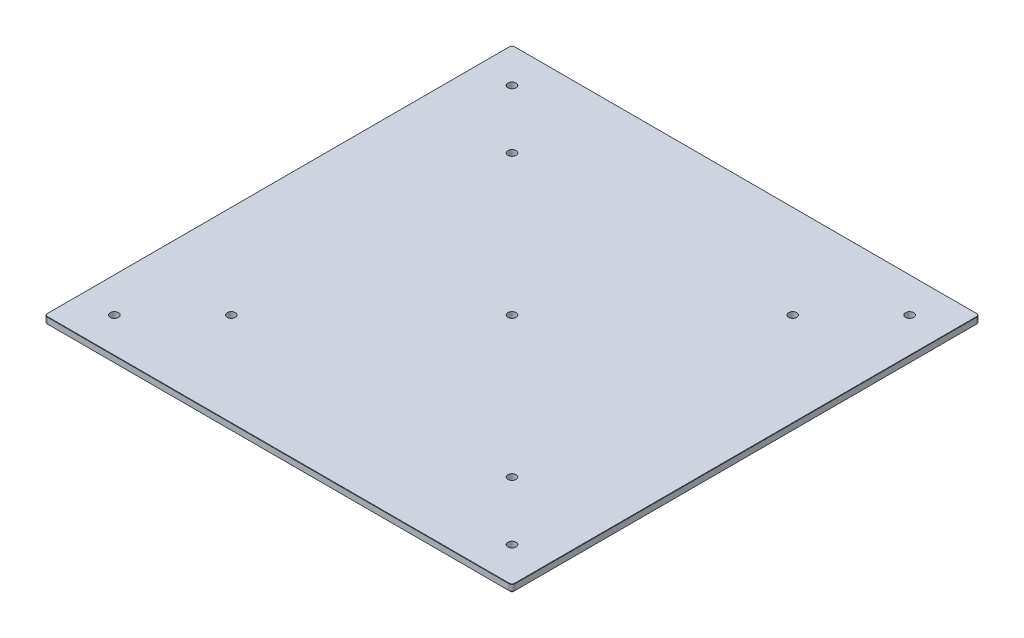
SolidWorks part; units mm, degrees
ref_plane "Front" through (0, 0, 0) normal (0, 0, 1) x (1, 0, 0)
ref_plane "Top" through (0, 0, 0) normal (0, 1, 0) x (1, 0, 0)
ref_plane "Right" through (0, 0, 0) normal (1, 0, 0) x (0, 0, -1)
sketch "Sketch1" plane through (0, 0, 0) normal (0, 1, 0) x (1, 0, 0)
  line L1 (-190.5, -190.5) -> (190.5, -190.5)
  line L2 (-190.5, -190.5) -> (-190.5, 190.5)
  line L3 (-190.5, 190.5) -> (190.5, 190.5)
  line L4 (190.5, -190.5) -> (190.5, 190.5)
  line L5 (-190.5, -190.5) -> (190.5, 190.5) construction
  line L6 (-190.5, 190.5) -> (190.5, -190.5) construction
  point P0 (0, 0)
  dimension "D1" = 381
extrude "Boss-Extrude1" add sketch "Sketch1" against normal blind 6.35
fillet "Fillet1" radius 2.54 4 edges at (190.5, -3.175, 190.5) (190.5, -3.175, -190.5) (-190.5, -3.175, -190.5) (-190.5, -3.175, 190.5)
chamfer "Chamfer1" distance 1.27 angle 45 8 edges at (0, -6.35, -190.5) (-189.7561, -6.35, -189.7561) (189.7561, -6.35, -189.7561) (-190.5, -6.35, 0) (190.5, -6.35, 0) (-189.7561, -6.35, 189.7561) (189.7561, -6.35, 189.7561) (0, -6.35, 190.5)
hole_wizard "1/4 Clearance Hole1" positions "Sketch3" profile "Sketch2" hole size "1/4" standard "Ansi Inch"
sketch "Sketch3" plane through (0, -6.35, 0) normal (0, -1, 0) x (1, 0, 0)
  line L1 (-114.3, 114.3) -> (114.3, 114.3)
  line L2 (-114.3, 114.3) -> (-114.3, -114.3)
  line L3 (-114.3, -114.3) -> (114.3, -114.3)
  line L4 (114.3, 114.3) -> (114.3, -114.3)
  line L5 (-114.3, 114.3) -> (114.3, -114.3) construction
  line L6 (-114.3, -114.3) -> (114.3, 114.3) construction
  point P0 (114.3, 114.3)
  point P3 (114.3, -114.3)
  point P7 (0, 0)
  point P12 (-114.3, 114.3)
  point P16 (-114.3, -114.3)
  point P19 (0, 0)
  dimension "D1" = 228.6
sketch "Sketch2" plane through (114.3, -6.35, 114.3) normal (1, 0, 0) x (0, 0, -1)
  line L0 (0, 0) -> (0, 6.35)
  line L1 (0, 6.35) -> (3.3782, 6.35)
  line L2 (3.3782, 6.35) -> (3.3782, 0)
  line L5 (3.3782, 0) -> (0, 0)
  line L11 (0, -6.35) -> (0, 107.95) construction
  dimension "Thru Hole Dia." = 6.7564
  dimension "Thru Hole Depth" = 6.35
chamfer "Chamfer2" distance 0.254 angle 45 8 edges at (0, 0, -190.5) (-189.7561, 0, -189.7561) (189.7561, 0, -189.7561) (-190.5, 0, 0) (190.5, 0, 0) (-189.7561, 0, 189.7561) (189.7561, 0, 189.7561) (0, 0, 190.5)
hole_wizard "1/4 Clearance Hole2" positions "Sketch5" profile "Sketch4" hole size "1/4" standard "Ansi Inch"
sketch "Sketch5" plane through (0, 0, 0) normal (0, 1, 0) x (-1, 0, 0)
  line L1 (161.925, 161.925) -> (-161.925, 161.925)
  line L2 (161.925, 161.925) -> (161.925, -161.925)
  line L3 (161.925, -161.925) -> (-161.925, -161.925)
  line L4 (-161.925, 161.925) -> (-161.925, -161.925)
  line L5 (161.925, 161.925) -> (-161.925, -161.925) construction
  line L6 (161.925, -161.925) -> (-161.925, 161.925) construction
  point P0 (161.925, -161.925)
  point P1 (-161.925, -161.925)
  point P3 (-161.925, 161.925)
  point P5 (161.925, 161.925)
  point P286 (0, 0)
  dimension "D1" = 323.85
sketch "Sketch4" plane through (-161.925, 0, -161.925) normal (1, 0, 0) x (0, 0, 1)
  line L0 (0, 0) -> (0, 6.35)
  line L1 (0, 6.35) -> (3.3782, 6.35)
  line L2 (3.3782, 6.35) -> (3.3782, 0)
  line L5 (3.3782, 0) -> (0, 0)
  line L11 (0, -6.35) -> (0, 107.95) construction
  dimension "Thru Hole Dia." = 6.7564
  dimension "Thru Hole Depth" = 6.35
